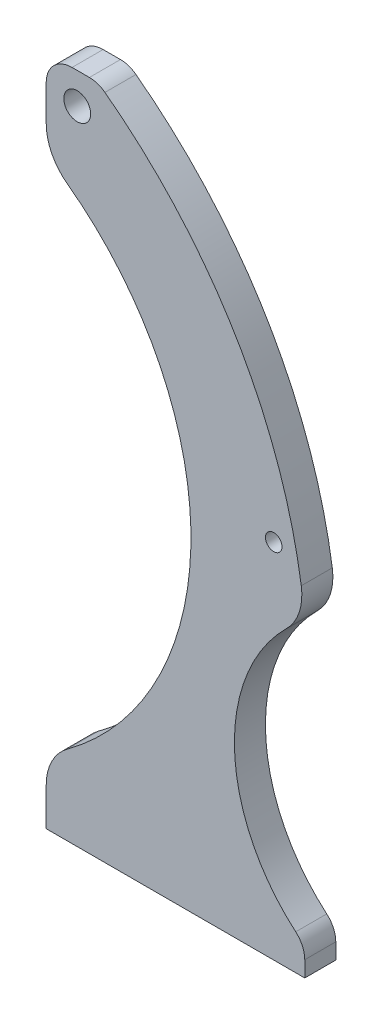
SolidWorks part; units mm, degrees
ref_plane "Plan de face" through (0, 0, 0) normal (0, 0, 1) x (1, 0, 0)
ref_plane "Plan de dessus" through (0, 0, 0) normal (0, 1, 0) x (1, 0, 0)
ref_plane "Plan de droite" through (0, 0, 0) normal (1, 0, 0) x (0, 0, -1)
sketch "Esquisse1" plane through (0, 0, 0) normal (0, 0, 1) x (1, 0, 0)
  line L1 (-27.9378, 53.975) -> (22.0622, 53.975)
  line L2 (-27.9378, 53.975) -> (-27.9378, -76.025)
  line L3 (-27.9378, -76.025) -> (22.0622, -76.025)
  line L4 (22.0622, 53.975) -> (22.0622, -76.025)
  dimension "D2" = 130
extrude "Extrusion1" add sketch "Esquisse1" along normal blind 6
ref_plane "Plan1" through (-27.9378, 53.975, 6) normal (-1, 0, 0) x (0, 0, 1)
ref_plane "Plan2" through (-27.9378, 53.975, 6) normal (-1, 0, 0) x (0, 0, 1)
sketch "Esquisse3" plane through (0, 0, 6) normal (0, 0, 1) x (1, 0, 0)
  line L0 (-7.9378, 53.975) -> (22.0622, 3.975)
  line L1 (22.0622, 53.975) -> (-27.9378, 53.975) construction
  line L2 (22.0622, -76.025) -> (22.0622, 53.975) construction
  line L3 (-27.9378, 53.975) -> (-27.9378, -76.025) construction
  line L4 (-27.9378, -76.025) -> (22.0622, -76.025) construction
  line L5 (-7.9378, 53.975) -> (22.0622, 53.975)
  line L6 (22.0622, 53.975) -> (22.0622, 3.975)
  circle A0 centre (-21.9378, 47.975) radius 2.6
  circle A1 centre (16.0622, -6.025) radius 1.6
  dimension "D3" = 5.2
  dimension "D4" = 6
  dimension "D5" = 6
  dimension "D6" = 6
  dimension "D7" = 70
  dimension "D8" = 3.2
  dimension "D1" = 20
  dimension "D2" = 80
extrude "Enlèv. mat.-Extru.1" cut sketch "Esquisse3" against normal blind 6
sketch "Esquisse4" plane through (0, 0, 6) normal (0, 0, 1) x (1, 0, 0)
  line L0 (-27.9378, 67.725) -> (-27.9378, 40.225) construction
  line L1 (-7.9378, 53.975) -> (-27.9378, 53.975) construction
  line L2 (22.0622, -76.025) -> (22.0622, 3.975) construction
  line L3 (-27.9378, 36.7856) -> (-27.9378, -63.408)
  line L4 (-17.9378, 53.975) -> (9.1226, 53.975)
  line L5 (9.1226, 53.975) -> (35.0987, 7.6288)
  line L6 (35.0987, 7.6288) -> (22.0622, -70.5647)
  arc A0 (-27.9378, -63.408) -> (-27.9378, 36.7856) centre (-58.7765, -13.3112) ccw
  arc A1 (-17.9378, 53.975) -> (22.0622, -16.2269) centre (-75.3284, -25.222) cw
  arc A2 (22.0622, -16.2269) -> (22.0622, -70.5647) centre (42.3827, -43.3958) ccw
extrude "Enlèv. mat.-Extru.2" cut sketch "Esquisse4" against normal blind 20
fillet "Congé1" radius 10 3 edges at (-27.9378, 36.7856, 3) (-27.9378, -63.408, 3) (22.0622, -16.2269, 3)
fillet "Congé2" radius 5 3 edges at (22.0622, -70.5647, 3) (-17.9378, 53.975, 3) (-27.9378, 53.975, 3)
